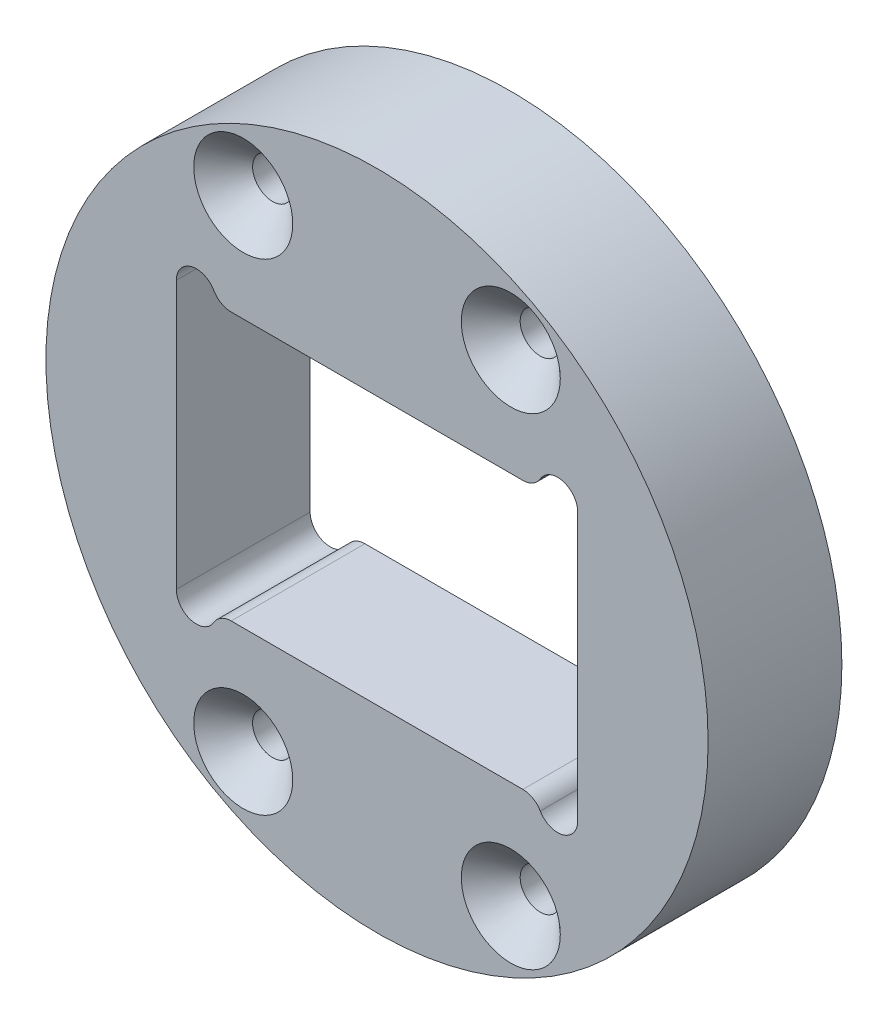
SolidWorks part; units mm, degrees
ref_plane "Plan de face" through (0, 0, 0) normal (0, 0, 1) x (1, 0, 0)
ref_plane "Plan de dessus" through (0, 0, 0) normal (0, 1, 0) x (1, 0, 0)
ref_plane "Plan de droite" through (0, 0, 0) normal (1, 0, 0) x (0, 0, -1)
sketch "Esquisse1" plane through (0, 0, 0) normal (0, 0, 1) x (1, 0, 0)
  line L4 (-10.9019, 10) -> (10.9019, 10)
  line L5 (15, 10) -> (15, -10)
  line L6 (10.9019, -10) -> (-10.9019, -10)
  line L7 (-15, -10) -> (-15, 10)
  line L8 (55, 0) -> (-55, 0) construction
  arc A0 (-12.201, 10.75) -> (-10.9019, 10) centre (-10.9019, 11.5) ccw
  arc A1 (10.9019, 10) -> (12.201, 10.75) centre (10.9019, 11.5) ccw
  arc A2 (15, 10) -> (12.201, 10.75) centre (13.5, 10) ccw
  arc A3 (12.201, -10.75) -> (15, -10) centre (13.5, -10) ccw
  arc A4 (12.201, -10.75) -> (10.9019, -10) centre (10.9019, -11.5) ccw
  arc A18 (-10.9019, -10) -> (-12.201, -10.75) centre (-10.9019, -11.5) ccw
  arc A19 (-15, -10) -> (-12.201, -10.75) centre (-13.5, -10) ccw
  arc A20 (-12.201, 10.75) -> (-15, 10) centre (-13.5, 10) ccw
  circle A24 centre (-10, 18) radius 1.5
  circle A25 centre (0, 0) radius 24.75
  circle A26 centre (10, 18) radius 1.5
  circle A27 centre (10, -18) radius 1.5
  circle A28 centre (-10, -18) radius 1.5
  dimension "D5" = 1.5
  dimension "D6" = 1.5
  dimension "D7" = 1.5
  dimension "D8" = 1.5
  dimension "D9" = 1.5
  dimension "D10" = 1.5
  dimension "D11" = 1.5
  dimension "D12" = 1.5
  dimension "D15" = 3
  dimension "D16" = 49.5
  dimension "D1" = 30
  dimension "D2" = 20
  dimension "D3" = 15
  dimension "D4" = 10
  dimension "D13" = 18
  dimension "D14" = 10
  dimension "D18" = 10
  dimension "D17" = 2
extrude "Boss.-Extru.1" add sketch "Esquisse1" along normal blind 10
chamfer "Chanfrein1" distance 2.2 angle 45 4 edges at (-11.5, -18, 10) (8.5, -18, 10) (11.5, 18, 10) (-8.5, 18, 10)
